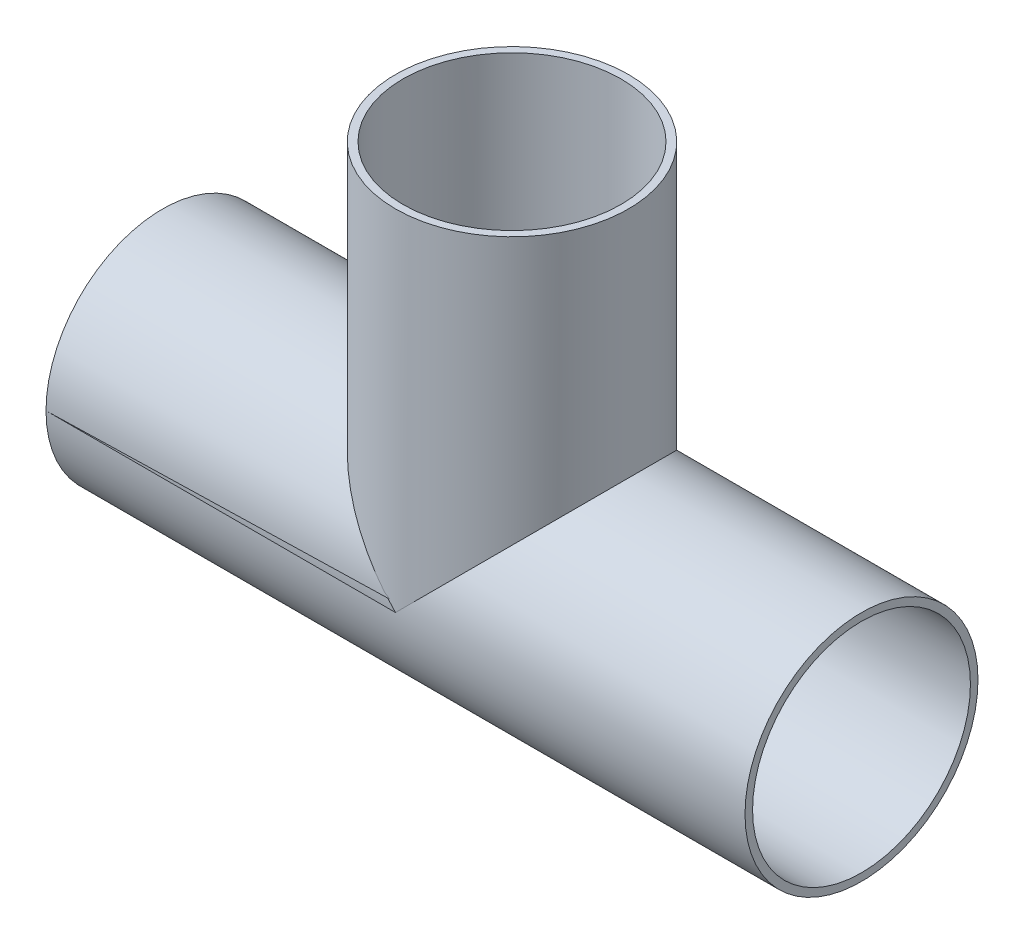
SolidWorks part; units mm, degrees
ref_plane "Front Plane" through (0, 0, 0) normal (0, 0, 1) x (1, 0, 0)
ref_plane "Top Plane" through (0, 0, 0) normal (0, 1, 0) x (1, 0, 0)
ref_plane "Right Plane" through (0, 0, 0) normal (1, 0, 0) x (0, 0, -1)
sketch "Sketch1" plane through (0, 0, 0) normal (0, 1, 0) x (1, 0, 0)
  circle A0 centre (0, 0) radius 25.4
extrude "Boss-Extrude1" add sketch "Sketch1" along normal blind 76.2
sketch "Sketch2" plane through (0, 0, 0) normal (1, 0, 0) x (0, 0, -1)
  circle A0 centre (0, 0) radius 25.4
extrude "Boss-Extrude2" add sketch "Sketch2" along normal mid plane 152.4
sketch "Sketch3" plane through (0, 76.2, 0) normal (0, 1, 0) x (1, 0, 0)
  circle A0 centre (0, 0) radius 23.749
extrude "Cut-Extrude1" cut sketch "Sketch3" against normal blind 76.2
sketch "Sketch4" plane through (76.2, 0, 0) normal (1, 0, 0) x (0, 0, -1)
  circle A0 centre (0, 0) radius 23.749
extrude "Cut-Extrude2" cut sketch "Sketch4" against normal through all
